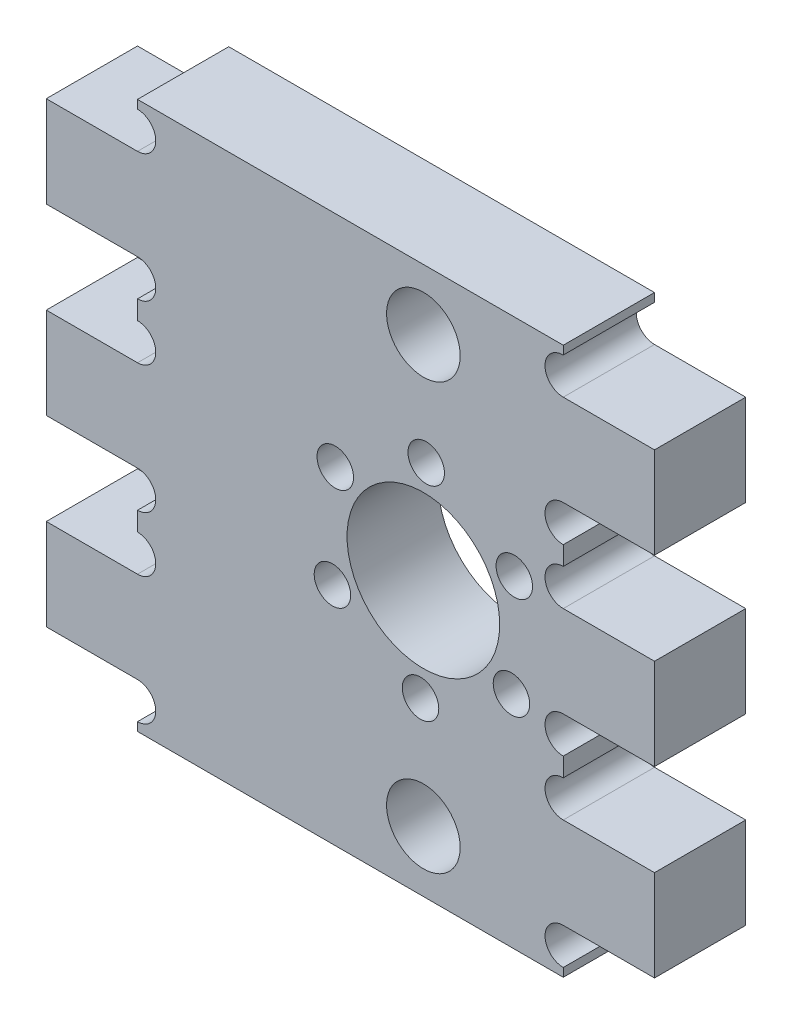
SolidWorks part; units mm, degrees
ref_plane "Ebene vorne" through (0, 0, 0) normal (0, 0, 1) x (1, 0, 0)
ref_plane "Ebene oben" through (0, 0, 0) normal (0, 1, 0) x (1, 0, 0)
ref_plane "Ebene rechts" through (0, 0, 0) normal (1, 0, 0) x (0, 0, -1)
sketch "Skizze1" plane through (0, 0, 0) normal (0, 0, 1) x (1, 0, 0)
  line L0 (96.5881, 0) -> (26.5881, 0)
  line L1 (96.5881, 0) -> (96.5881, 1.4)
  line L2 (26.5881, 0) -> (26.5881, 1.4)
  line L3 (26.5881, 90) -> (96.5881, 90)
  line L5 (111.5881, 7.4) -> (111.5881, 22.4)
  line L6 (111.5881, 22.4) -> (96.5881, 22.4)
  line L7 (111.5881, 7.4) -> (96.5881, 7.4)
  line L8 (96.5881, 37.5) -> (111.5881, 37.5)
  line L9 (111.5881, 37.5) -> (111.5881, 52.5)
  line L10 (111.5881, 52.5) -> (96.5881, 52.5)
  line L11 (96.5881, 67.6) -> (111.5881, 67.6)
  line L12 (111.5881, 67.6) -> (111.5881, 82.6)
  line L13 (111.5881, 82.6) -> (96.5881, 82.6)
  line L14 (96.5881, 90) -> (96.5881, 88.6)
  line L15 (96.5881, 61.6) -> (96.5881, 58.5)
  line L16 (96.5881, 31.5) -> (96.5881, 28.4)
  line L17 (26.5881, 7.4) -> (11.5881, 7.4)
  line L18 (11.5881, 7.4) -> (11.5881, 22.4)
  line L19 (11.5881, 22.4) -> (26.5881, 22.4)
  line L20 (26.5881, 37.5) -> (11.5881, 37.5)
  line L21 (11.5881, 37.5) -> (11.5881, 52.5)
  line L22 (11.5881, 52.5) -> (26.5881, 52.5)
  line L23 (26.5881, 67.6) -> (11.5881, 67.6)
  line L24 (11.5881, 67.6) -> (11.5881, 82.6)
  line L25 (11.5881, 82.6) -> (26.5881, 82.6)
  line L26 (26.5881, 90) -> (26.5881, 88.6)
  line L27 (26.5881, 61.6) -> (26.5881, 58.5)
  line L29 (26.5881, 31.5) -> (26.5881, 28.4)
  arc A0 (96.5881, 88.6) -> (96.5881, 82.6) centre (96.5881, 85.6) ccw
  arc A1 (96.5881, 67.6) -> (96.5881, 61.6) centre (96.5881, 64.6) ccw
  arc A2 (96.5881, 58.5) -> (96.5881, 52.5) centre (96.5881, 55.5) ccw
  arc A3 (96.5881, 37.5) -> (96.5881, 31.5) centre (96.5881, 34.5) ccw
  arc A4 (96.5881, 28.4) -> (96.5881, 22.4) centre (96.5881, 25.4) ccw
  arc A5 (96.5881, 7.4) -> (96.5881, 1.4) centre (96.5881, 4.4) ccw
  arc A6 (26.5881, 88.6) -> (26.5881, 82.6) centre (26.5881, 85.6) cw
  arc A7 (26.5881, 67.6) -> (26.5881, 61.6) centre (26.5881, 64.6) cw
  arc A8 (26.5881, 58.5) -> (26.5881, 52.5) centre (26.5881, 55.5) cw
  arc A9 (26.5881, 37.5) -> (26.5881, 31.5) centre (26.5881, 34.5) cw
  arc A10 (26.5881, 28.4) -> (26.5881, 22.4) centre (26.5881, 25.4) cw
  arc A11 (26.5881, 7.4) -> (26.5881, 1.4) centre (26.5881, 4.4) cw
  dimension "D13" = 7.4
  dimension "D14" = 15.1
  dimension "D15" = 7.4
  dimension "D16" = 15
  dimension "D17" = 3
  dimension "D18" = 3
  dimension "D9" = 15
  dimension "D10" = 15
  dimension "D6" = 3
  dimension "D26" = 15
  dimension "D19" = 3
  dimension "D20" = 3
  dimension "D5" = 3
  dimension "D27" = 15.1
  dimension "D28" = 15
  dimension "D2" = 3
  dimension "D4" = 3
  dimension "D7" = 3
  dimension "D8" = 3
  dimension "D21" = 3
  dimension "D22" = 3
  dimension "D1" = 70
  dimension "D11" = 15
  dimension "D12" = 15.1
  dimension "D23" = 15
  dimension "D24" = 15
  dimension "D25" = 15
  dimension "D29" = 15.1
  dimension "D30" = 7.4
  dimension "D31" = 15
  dimension "D32" = 15
  dimension "D33" = 15
  dimension "D34" = 90
  dimension "D35" = 15
  dimension "D36" = 15
  dimension "D37" = 15
  dimension "D38" = 15
  dimension "D39" = 15
extrude "outline" add sketch "Skizze1" along normal blind 15
sketch "Skizze2" plane through (0, 0, 15) normal (0, 0, 1) x (1, 0, 0)
  line L0 (96.5881, 88.6) -> (96.5881, 90) construction
  line L2 (96.5881, 90) -> (26.5881, 90) construction
  circle A0 centre (73.5881, 80) radius 6.05
  circle A31 centre (73.5881, 45) radius 12.55
  circle A32 centre (73.5881, 10) radius 6.05
  dimension "D38" = 25.1
  dimension "D39" = 12.1
  dimension "D6" = 12.1
  dimension "D1" = 35
  dimension "D2" = 23
  dimension "D7" = 70
  dimension "D8" = 10
extrude "inner" cut sketch "Skizze2" against normal blind 15 contours A0
sketch "Skizze3" plane through (0, 0, 0) normal (0, 0, -1) x (-1, 0, 0)
  circle A0 centre (-74.0564, 61.9935) radius 3
  circle A1 centre (-59.1054, 53.9023) radius 3
  circle A2 centre (-58.6371, 36.9088) radius 3
  circle A3 centre (-73.1198, 28.0065) radius 3
  circle A4 centre (-88.0708, 36.0977) radius 3
  circle A5 centre (-88.5391, 53.0912) radius 3
  circle A6 centre (-73.5881, 45) radius 12.55 construction
  dimension "D1" = 6
  dimension "D2" = 6
  dimension "D3" = 6
  dimension "D4" = 6
  dimension "D5" = 6
  dimension "D6" = 6
  dimension "D8" = 17
  dimension "D9" = 17
  dimension "D10" = 17
  dimension "D11" = 17
  dimension "D12" = 17
  dimension "D13" = 17
  dimension "D14" = 17
  dimension "D15" = 17
  dimension "D16" = 17
  dimension "D17" = 17
  dimension "D18" = 17
  dimension "D7" = 17
extrude "holes" cut sketch "Skizze3" against normal blind 20
equation "\"R3\"=1.76067"
